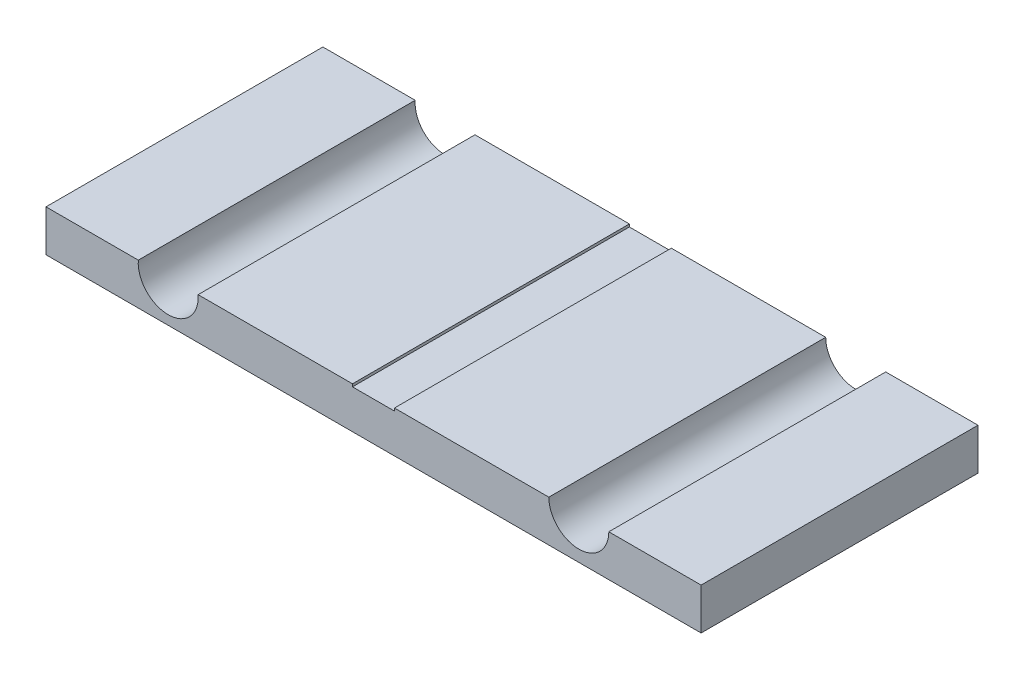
SolidWorks part; units mm, degrees
ref_plane "Front Plane" through (0, 0, 0) normal (0, 0, 1) x (1, 0, 0)
ref_plane "Top Plane" through (0, 0, 0) normal (0, 1, 0) x (1, 0, 0)
ref_plane "Right Plane" through (0, 0, 0) normal (1, 0, 0) x (0, 0, -1)
sketch "Sketch1" plane through (0, 0, 0) normal (0, 0, 1) x (1, 0, 0)
  line L0 (0.8491, -3.9654) -> (34.3041, -3.9654)
  line L1 (-32.1116, -3.9654) -> (-12.1116, -3.9654)
  line L2 (-32.1116, -3.9654) -> (-32.1116, -12.9654)
  line L3 (-32.1116, -12.9654) -> (109.8491, -12.9654)
  line L4 (109.8491, -3.9654) -> (109.8491, -12.9654)
  line L5 (89.8491, -3.9654) -> (109.8491, -3.9654)
  line L6 (43.3941, -3.9654) -> (76.8491, -3.9654)
  line L8 (43.3941, -3.9654) -> (43.3941, -4.5404)
  line L9 (43.3941, -4.5404) -> (34.3041, -4.5404)
  line L11 (34.3041, -3.9654) -> (34.3041, -4.5404)
  arc A0 (-12.1116, -3.9654) -> (0.8491, -3.9654) centre (-5.6313, -4.4701) ccw
  arc A1 (76.8491, -3.9654) -> (89.8491, -3.9654) centre (83.3491, -3.9651) ccw
  dimension "D2" = 6.5
  dimension "D1" = 9
  dimension "D3" = 76
  dimension "D4" = 20
  dimension "D5" = 20
  dimension "D6" = 9.09
extrude "Boss-Extrude1" add sketch "Sketch1" against normal blind 60
